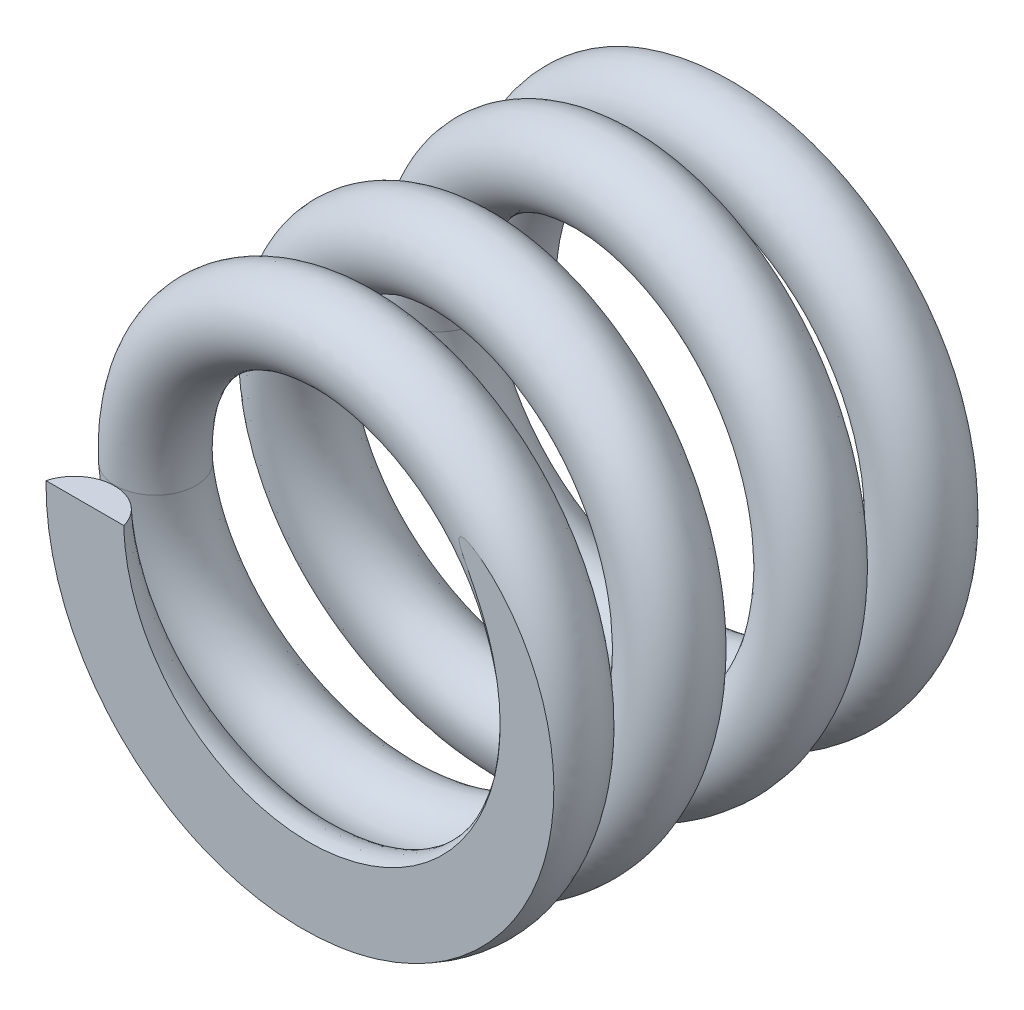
SolidWorks part; units mm, degrees
ref_plane "Front Plane" through (0, 0, 0) normal (0, 0, 1) x (1, 0, 0)
ref_plane "Top Plane" through (0, 0, 0) normal (0, 1, 0) x (1, 0, 0)
ref_plane "Right Plane" through (0, 0, 0) normal (1, 0, 0) x (0, 0, -1)
sketch "Sketch2" plane through (0, 0, 0) normal (0, 0, 1) x (1, 0, 0)
  circle A0 centre (0, 0) radius 9.3782
sketch "Sketch3" plane through (0, 0, 0) normal (0, 1, 0) x (1, 0, 0)
  circle A0 centre (-7.9333, 0) radius 1.4499
  dimension "D1" = 2.8998
curve "Helix/Spiral1"
sweep "Sweep1" add profiles "Sketch3" path "Helix/Spiral1"
sketch "Sketch6" plane through (0, 0, 0) normal (0, -1, 0) x (1, 0, 0)
  circle A1 centre (-7.9333, 0) radius 1.4499
  circle A2 centre (-7.9333, 0) radius 1.4499
  dimension "D1" = 0
sketch "Sketch7" plane through (0, 0, 0) normal (0, 0, 1) x (1, 0, 0)
  circle A0 centre (0, 0) radius 7.9051
curve "Helix/Spiral2"
sweep "Sweep2" add profiles "Sketch6" path "Helix/Spiral2"
sketch "Sketch8" plane through (0, 0, 0) normal (0, 1, 0) x (1, 0, 0)
  line L1 (-11.0314, 7.3091) -> (10.7141, 7.3091)
  line L2 (-11.0314, 7.3091) -> (-11.0314, 2.794)
  line L3 (-11.0314, 2.794) -> (10.7141, 2.794)
  line L4 (10.7141, 7.3091) -> (10.7141, 2.794)
  dimension "D1" = 2.794
extrude "Cut-Extrude3" cut sketch "Sketch8" against normal through all both and the other way through all
ref_plane "Plane1" through (0, 0, 12.7) normal (0, 0, 1) x (1, 0, 0)
sketch "Sketch10" plane through (0, 0, 12.7) normal (0, 0, 1) x (1, 0, 0)
  circle A0 centre (0, 0) radius 8.105
curve "Helix/Spiral3"
sketch "Sketch11" plane through (0, 0, 0) normal (0, 1, 0) x (1, 0, 0)
  circle A1 centre (-7.9333, -10.16) radius 1.4499
  circle A2 centre (-7.9333, -10.16) radius 1.4499
  dimension "D1" = 0
sweep "Sweep3" add profiles "Sketch11" path "Helix/Spiral3"
sketch "Sketch4" plane through (0, 0, 0) normal (0, 1, 0) x (1, 0, 0)
  line L0 (8.5564, 2.794) -> (-9.3777, 2.794) construction
  line L5 (-13.9293, -12.7) -> (13.8177, -12.7)
  line L6 (-13.9293, -12.7) -> (-13.9293, -20.9155)
  line L7 (-13.9293, -20.9155) -> (13.8177, -20.9155)
  line L8 (13.8177, -12.7) -> (13.8177, -20.9155)
  dimension "D1" = 15.494
extrude "Cut-Extrude4" cut sketch "Sketch4" against normal through all both and the other way through all
